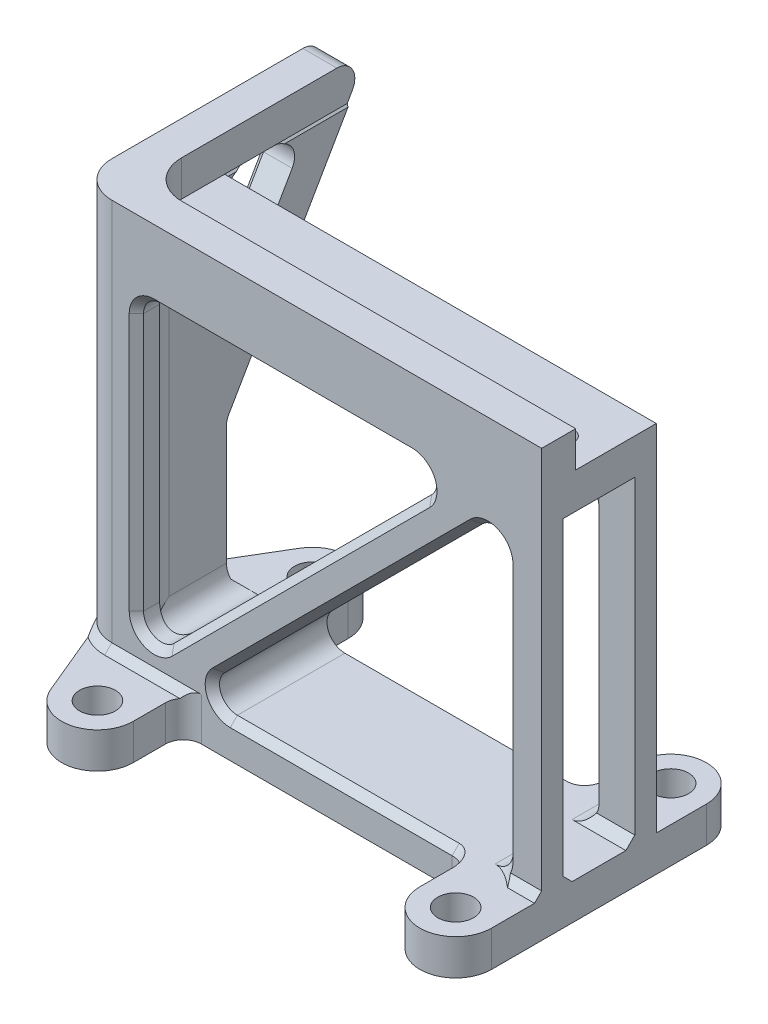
SolidWorks part; units mm, degrees
ref_plane "Ebene vorne" through (0, 0, 0) normal (0, 0, 1) x (1, 0, 0)
ref_plane "Ebene oben" through (0, 0, 0) normal (0, 1, 0) x (1, 0, 0)
ref_plane "Ebene rechts" through (0, 0, 0) normal (1, 0, 0) x (0, 0, -1)
sketch "Skizze1" plane through (0, 0, 0) normal (0, 1, 0) x (1, 0, 0)
  line L0 (-60, 0) -> (60, 0) construction
  line L1 (-60, 6) -> (60, 6)
  line L2 (-60, 6) -> (-60, -6)
  line L3 (-60, -6) -> (60, -6)
  line L4 (60, 6) -> (60, -6)
  line L5 (-60, 6) -> (60, -6) construction
  line L6 (-60, -6) -> (60, 6) construction
  line L7 (0, -6) -> (0, 6) construction
  circle A0 centre (-50, 0) radius 3
  circle A1 centre (50, 0) radius 3
  point P0 (0, 0)
  dimension "D4" = 6
  dimension "D1" = 120
  dimension "D2" = 12
  dimension "D3" = 100
extrude "Aufsatz-Linear austragen1" add sketch "Skizze1" along normal blind 10
sketch "Skizze2" plane through (0, 10, 0) normal (0, 1, 0) x (1, 0, 0)
  line L0 (-70, 6) -> (-60, 6)
  line L1 (-60, 6) -> (-60, -6)
  line L2 (-60, -6) -> (60, -6)
  line L3 (60, -6) -> (60, -16)
  line L14 (-70, 6) -> (-70, -16)
  line L15 (-70, -16) -> (60, -16)
  line L16 (-70, 6) -> (-70, -16)
  line L17 (-70, -16) -> (60, -16)
  dimension "D1" = 10
extrude "Aufsatz-Linear austragen2" add sketch "Skizze2" against normal mid plane 20
sketch "Skizze3" plane through (0, 0, -6) normal (0, 0, -1) x (-1, 0, 0)
  line L6 (-60, 0) -> (70, 0)
  line L7 (70, 0) -> (70, 20)
  line L8 (70, 20) -> (60, 20)
  line L9 (60, 20) -> (60, 10)
  line L10 (60, 10) -> (-60, 10)
  line L11 (-60, 10) -> (-60, 0)
  line L12 (-60, 0) -> (70, 0)
  line L13 (70, 0) -> (70, 20)
  line L14 (70, 20) -> (60, 20)
  line L15 (60, 20) -> (60, 10)
  line L16 (60, 10) -> (-60, 10)
  line L17 (-60, 10) -> (-60, 0)
  dimension "D1" = 0
extrude "Aufsatz-Linear austragen3" add sketch "Skizze3" along normal blind 10
fillet "Verrundung1" radius 10 1 edges at (-60, 15, 6)
ref_plane "Ebene1" through (0, -99, 0) normal (0, 1, 0) x (1, 0, 0)
fillet "Verrundung2" radius 10 1 edges at (-70, 10, 16)
sketch "Skizze5" plane through (0, 0, 0) normal (0, -1, 0) x (1, 0, 0)
  line L0 (-40, 0) -> (-40, -16)
  line L1 (60, -16) -> (-70, -16) construction
  line L2 (50, 10) -> (60, 10)
  line L3 (60, 16) -> (60, -16) construction
  line L4 (60, 10) -> (60, 16)
  line L5 (-70, -16) -> (-70, 6) construction
  line L6 (-60, 16) -> (60, 16) construction
  line L7 (-70, -16) -> (-70, 6)
  line L8 (-60, 16) -> (60, 16)
  line L9 (-70, -16) -> (-60, -16)
  line L10 (-60, -16) -> (-60, 0)
  line L11 (0, 0) -> (0, -16) construction
  line L12 (40, -16) -> (-40, -16)
  line L13 (40, 0) -> (40, -16) construction
  line L14 (40, 0) -> (60, 0) construction
  line L15 (50, -10) -> (60, -10)
  line L16 (60, -10) -> (60, -16)
  line L17 (60, -16) -> (40, -16)
  arc A0 (50, 10) -> (50, -10) centre (50, 0) ccw
  arc A1 (-40, 0) -> (-60, 0) centre (-50, 0) ccw
  arc A2 (-60, 16) -> (-70, 6) centre (-60, 6) ccw construction
  arc A3 (-60, 16) -> (-70, 6) centre (-60, 6) ccw
  dimension "D1" = 10
extrude "Aufsatz-Linear austragen4" add sketch "Skizze5" along normal up to surface (99 mm away)
sketch "Skizze6" plane through (0, 0, 16) normal (0, 0, 1) x (1, 0, 0)
  line L0 (50, 20) -> (50, 0) construction
  line L1 (-60, 20) -> (60, 20) construction
  line L2 (50, 0) -> (60, 0) construction
  line L3 (60, -89) -> (-60, -89) construction
  line L4 (60, -99) -> (60, 20) construction
  line L5 (-60, 20) -> (-60, -99) construction
  line L6 (12.1, -99) -> (-12.1, -99) construction
  line L7 (50, 0) -> (50, -89)
  line L8 (50, -89) -> (-39, -89)
  line L9 (-39, -89) -> (50, 0)
  line L10 (-53.1421, -89) -> (35.8579, 0)
  line L11 (35.8579, 0) -> (-53.1421, 0)
  line L12 (-53.1421, 0) -> (-53.1421, -89)
  dimension "D1" = 10
  dimension "D2" = 10
  dimension "D3" = 10
extrude "Schnitt-Linear austragen1" cut sketch "Skizze6" against normal through all
sketch "Skizze11" plane through (0, -99, 0) normal (0, -1, 0) x (1, 0, 0)
  line L1 (60, 10) -> (50, 10) construction
  line L3 (60, 10) -> (50, 10)
  line L4 (60, 10) -> (60, -16)
  line L5 (60, -16) -> (40, -16)
  line L6 (40, -16) -> (40, 0)
  line L8 (60, -16) -> (-40, -16) construction
  arc A0 (50, 10) -> (50, -10) centre (50, 0) ccw construction
  arc A1 (50, 10) -> (40, 0) centre (50, 0) ccw
extrude "Aufsatz-Linear austragen6" add sketch "Skizze11" against normal up to surface (10 mm away)
sketch "Skizze7" plane through (0, -99, 0) normal (0, -1, 0) x (1, 0, 0)
  line L0 (-40, -16) -> (-40, 0) construction
  line L1 (-60, 0) -> (-60, -16) construction
  line L2 (-40, -16) -> (-40, 0)
  line L3 (-60, 0) -> (-60, -16)
  line L4 (-40, -16) -> (-60, -16)
  arc A0 (-40, 0) -> (-60, 0) centre (-50, 0) ccw construction
  arc A1 (-40, 0) -> (-60, 0) centre (-50, 0) ccw
extrude "Aufsatz-Linear austragen5" add sketch "Skizze7" against normal up to surface (23.1421 mm away)
fillet "Verrundung3" radius 5 8 edges at (-53.1421, 0, 12.7468) (-53.1421, -89, 12.7468) (50, 0, 13) (50, -89, 13) (35.8579, 0, 0) (-39, -89, 0) (50, 0, -13) (50, -89, -13)
chamfer "Fase10" distance 2.5 angle 45 2 edges at (52.5, -89, -10) (52.5, -89, 10)
fillet "Verrundung5" radius 5 1 edges at (-60, -95.8579, -8)
sketch "Skizze12" plane through (0, -99, 0) normal (0, -1, 0) x (1, 0, 0)
  line L0 (50, 0) -> (-50, 0) construction
  line L1 (50, 0) -> (50, -30) construction
  line L2 (0, 0) -> (0, -16) construction
  line L3 (60, -16) -> (-70, -16) construction
  line L4 (60, -16) -> (60, -30)
  line L5 (40, -16) -> (40, -30)
  line L6 (60, -16) -> (40, -16)
  line L7 (-40, -16) -> (-40, -30)
  line L8 (-40, 16) -> (-40, 30)
  line L9 (60, 16) -> (40, 16)
  line L10 (40, 16) -> (40, 30)
  line L11 (60, 16) -> (60, 30)
  line L12 (-58.5872, -35.1245) -> (-70, -16)
  line L13 (-59.2308, 33.8462) -> (-69.2308, 9.8462)
  line L14 (-40, 16) -> (-60, 16)
  line L15 (-40, -16) -> (-70, -16)
  circle A0 centre (50, -30) radius 5
  arc A1 (60, -30) -> (50, -40) centre (50, -30) cw
  arc A2 (40, -30) -> (50, -40) centre (50, -30) ccw
  circle A3 centre (-50, -30) radius 5
  arc A4 (-40, -30) -> (-50, -40) centre (-50, -30) cw
  arc A5 (-40, 30) -> (-50, 40) centre (-50, 30) ccw
  circle A6 centre (-50, 30) radius 5
  arc A7 (40, 30) -> (50, 40) centre (50, 30) cw
  arc A8 (60, 30) -> (50, 40) centre (50, 30) ccw
  circle A9 centre (50, 30) radius 5
  arc A10 (-50, 40) -> (-59.2308, 33.8462) centre (-50, 30) ccw
  arc A11 (-60, 16) -> (-70, 6) centre (-60, 6) ccw construction
  arc A13 (-50, -40) -> (-58.5872, -35.1245) centre (-50, -30) cw
  arc A14 (-60, 16) -> (-69.2308, 9.8462) centre (-60, 6) ccw
  point P4 (0, 0)
  dimension "D3" = 10
  dimension "D1" = 100
  dimension "D2" = 30
extrude "Aufsatz-Linear austragen7" add sketch "Skizze12" against normal blind 10
sketch "Skizze13" plane through (-70, 0, 0) normal (-1, 0, 0) x (0, 0, 1)
  line L0 (-16, 20) -> (-56, 20)
  line L1 (-56, 20) -> (-16, -49.282)
  line L2 (-16, -89) -> (-16, 20) construction
  line L3 (-16, -49.282) -> (-16, 20)
  line L4 (-16, 10) -> (-38.6795, 10)
  line L5 (-38.6795, 10) -> (-16, -29.282)
  line L6 (-38.6795, 10) -> (-7.3397, -44.282) construction
  dimension "D1" = 30
  dimension "D2" = 40
  dimension "D3" = 10
extrude "Aufsatz-Linear austragen9" add sketch "Skizze13" against normal up to surface (10 mm away)
fillet "Verrundung8" radius 5 5 edges at (-65, 20, -56) (-65, -49.282, -16) (-65, -29.282, -16) (-65, 10, -16) (-65, 10, -38.6795)
chamfer "Fase2" distance 2 angle 45 18 edges at (48.5355, -87.5355, 16) (50, -48.0355, 16) (46.9134, -7.4517, 16) (5.5, -44.5, 16) (-8.6421, -44.5, 16) (28.4062, -3.0866, 16) (-12.1777, 0, 16) (-51.6777, -1.4645, 16) (-50.0556, -81.5483, 16) (-53.1421, -40.9645, 16) (-31.5483, -85.9134, 16) (6.5355, -89, 16) (-70, -15.4514, -19.7059) (-70, -2.8109, -16) (-70, 8.5355, -17.4645) (-70, 10, -25.5096) (-70, 7.5, -34.3494) (-70, -5.3109, -29.8397)
fillet "Verrundung6" radius 5 4 edges at (-40, -94, -16) (40, -94, -16) (40, -95, 16) (-40, -94, 16)
fillet "Verrundung7" radius 5 1 edges at (40, -92.5, 17.5)
chamfer "Fase9" distance 2 angle 45 4 edges at (-52.5, -89, -16) (-65.547, -89, 14.3205) (-47.5, -89, 16) (54.9495, -89, 16)
sketch "Skizze14" plane through (0, 20, 0) normal (0, 1, 0) x (1, 0, 0)
  line L7 (-60, 47.3397) -> (-60, 52.3397) construction
  line L8 (-60, 4) -> (-60, 47.3397) construction
  line L9 (-50, -6) -> (60, -6) construction
  line L10 (-60, 47.3397) -> (-60, 52.3397)
  line L11 (-60, 4) -> (-60, 47.3397)
  line L12 (-50, -6) -> (60, -6)
  line L13 (-60.5, 47.3397) -> (-60.5, 52.3397)
  line L14 (-60.5, 4) -> (-60.5, 47.3397)
  line L15 (-50, -6.5) -> (60, -6.5)
  line L16 (60, -6.5) -> (60, -6)
  line L17 (-60, 52.3397) -> (-60.5, 52.3397)
  arc A3 (-60, 4) -> (-50, -6) centre (-50, 4) ccw construction
  arc A4 (-60, 4) -> (-50, -6) centre (-50, 4) ccw
  arc A5 (-60.5, 4) -> (-50, -6.5) centre (-50, 4) ccw
  dimension "D1" = 0.5
extrude "Schnitt-Linear austragen2" cut sketch "Skizze14" against normal up to surface (10 mm away)
chamfer "Fase11" distance 0.5 angle 45 2 edges at (-60, 10, -40.1229) (-60, 10, -18.5)
